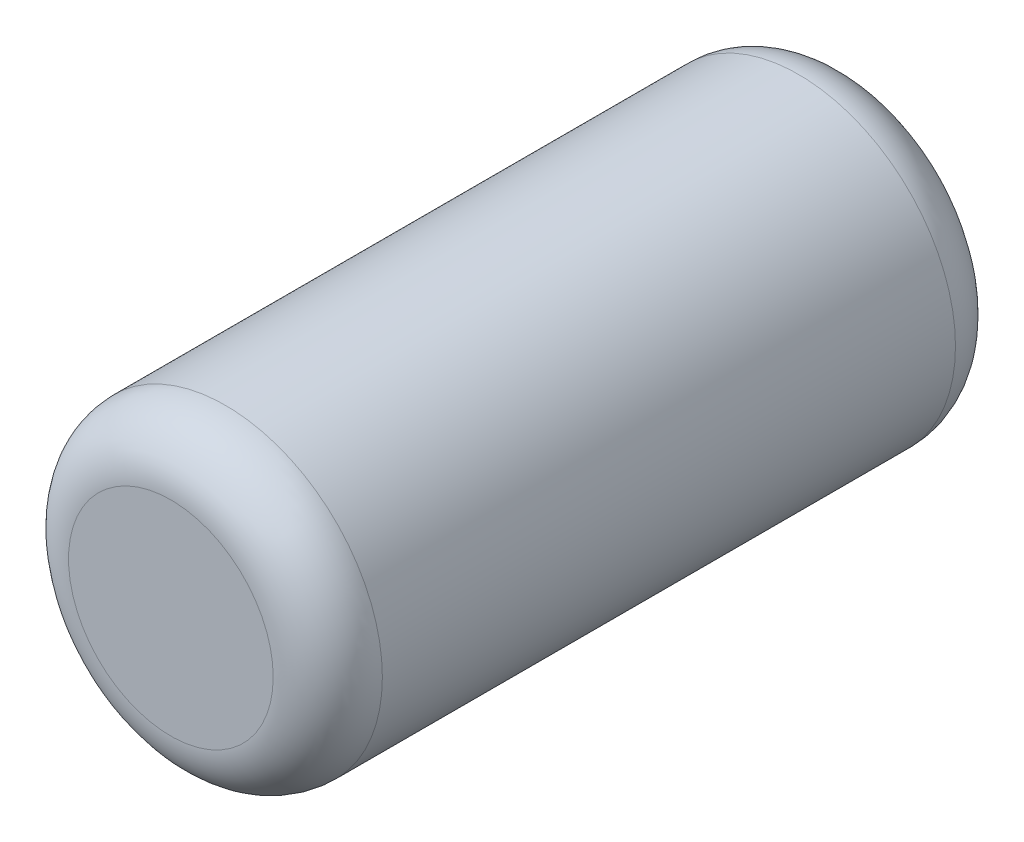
SolidWorks part; units mm, degrees
ref_plane "Front Plane" through (0, 0, 0) normal (0, 0, 1) x (1, 0, 0)
ref_plane "Top Plane" through (0, 0, 0) normal (0, 1, 0) x (1, 0, 0)
ref_plane "Right Plane" through (0, 0, 0) normal (1, 0, 0) x (0, 0, -1)
sketch "Sketch1" plane through (0, 0, 0) normal (0, 0, 1) x (1, 0, 0)
  circle A0 centre (0, 0) radius 575
  dimension "D1" = 1150
extrude "Boss-Extrude1" add sketch "Sketch1" along normal blind 2500
fillet "Fillet1" radius 200 2 edges at (575, 0, 2500) (575, 0, 0)
sketch "Sketch2" plane through (0, 0, 0) normal (0, 0, -1) x (-1, 0, 0)
  circle A0 centre (0, 0) radius 100
extrude "Boss-Extrude2" add sketch "Sketch2" along normal blind 200
fillet "Fillet2" radius 200 1 edges at (100, 0, 0)
scale "Scale1" scale about centroid uniform scaling yes scale factor 0.105
